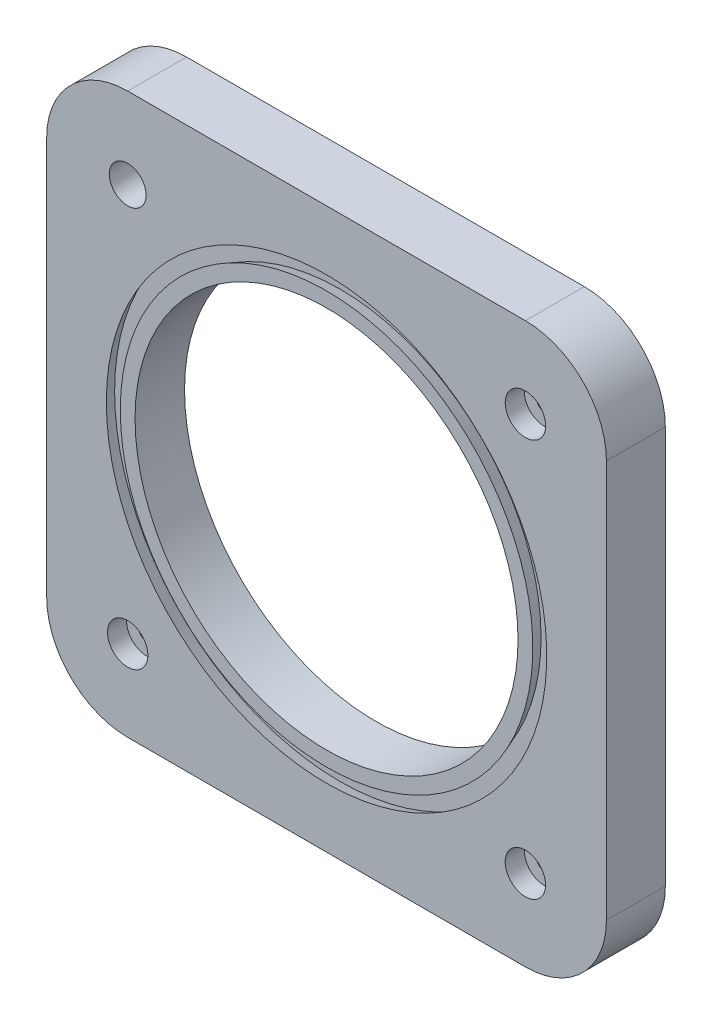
SolidWorks part; units mm, degrees
ref_plane "Plane1" through (0, 0, 0) normal (0, 0, 1) x (1, 0, 0)
ref_plane "Plane2" through (0, 0, 0) normal (0, 1, 0) x (1, 0, 0)
ref_plane "Plane3" through (0, 0, 0) normal (1, 0, 0) x (0, 0, -1)
sketch "Sketch1" plane through (0, 0, 0) normal (0, 0, 1) x (1, 0, 0)
  line L0 (120.65, 85.725) -> (120.65, -85.725)
  line L1 (-120.65, 85.725) -> (-120.65, -85.725)
  line L2 (85.725, -120.65) -> (-85.725, -120.65)
  line L3 (85.725, 120.65) -> (-85.725, 120.65)
  arc A0 (-120.65, 85.725) -> (-85.725, 120.65) centre (-85.725, 85.725) cw
  arc A1 (-85.725, -120.65) -> (-120.65, -85.725) centre (-85.725, -85.725) cw
  arc A2 (85.725, -120.65) -> (120.65, -85.725) centre (85.725, -85.725) ccw
  arc A3 (85.725, 120.65) -> (120.65, 85.725) centre (85.725, 85.725) cw
  circle A4 centre (0, 0) radius 82.55
  circle A5 centre (-85.725, -85.725) radius 3.3655
  circle A7 centre (85.725, 85.725) radius 3.3655
  circle A8 centre (85.725, -85.725) radius 3.3655
  circle A9 centre (-85.725, 85.725) radius 7.9375
  point P5 (-120.65, 120.65)
  point P14 (120.65, 120.65)
  dimension "D5" = 165.1
  dimension "D6" = 85.725
  dimension "D7" = 34.925
  dimension "D9" = 34.925
  dimension "D10" = 85.725
  dimension "D11" = 85.725
  dimension "D8" = 34.925
  dimension "D12" = 85.725
  dimension "D13" = 85.725
  dimension "D14" = 120.65
  dimension "D15" = 6.731
  dimension "D16" = 6.731
  dimension "D17" = 6.731
  dimension "D18" = 15.875
  dimension "D21" = 85.725
  dimension "D22" = 34.925
  dimension "D23" = 171.45
  dimension "D2" = 120.65
  dimension "D3" = 241.3
  dimension "D4" = 241.3
  dimension "D19" = 85.725
  dimension "D20" = 85.725
extrude "Base-Extrude" add sketch "Sketch1" along normal blind 25.4
sketch "Sketch2" plane through (0, 0, 25.4) normal (0, 0, 1) x (1, 0, 0)
  circle A0 centre (0, 0) radius 95.5675
  dimension "D1" = 191.135
sketch "Sketch3" plane through (0, 0, 25.4) normal (0, 0, 1) x (1, 0, 0)
  circle A0 centre (0, 0) radius 94.9325
  dimension "D1" = 189.865
sketch "Sketch4" plane through (0, 0, 0) normal (1, 0, 0) x (0, 0, -1)
  line L0 (-25.4, 94.9325) -> (-25.4, 77.5467) construction
  line L1 (-25.4, 94.9325) -> (-25.4, -94.9325) construction
  line L6 (-25.4, 91.9226) -> (-18.4374, 91.9226) construction
  line L8 (-19.6596, 97.1016) -> (-25.4, 94.9325)
  line L9 (-19.6596, 97.1016) -> (-19.6596, 86.7436)
  line L10 (-19.6596, 86.7436) -> (-25.4, 88.9127)
  line L11 (-25.4, 88.9127) -> (-25.4, 94.9325)
  point P11 (-19.6596, 91.9226)
  point P19 (-19.6596, 91.9226)
  dimension "D2" = 6.0198
  dimension "D3" = 41.4
  dimension "D4" = 5.7404
  dimension "D5" = 20.7
sweep "Cut-Sweep1" cut profiles "Sketch4" path "Sketch3"
sketch "Sketch5" plane through (0, 0, 25.4) normal (0, 0, 1) x (1, 0, 0)
  circle A0 centre (0, 0) radius 95.5675
  dimension "D1" = 191.135
extrude "Cut-Extrude2" [suppressed] cut sketch "Sketch5" against normal blind 4.572
sketch "Sketch6" plane through (0, 0, 0) normal (0, 0, -1) x (-1, 0, 0)
  line L0 (0, 0) -> (32.9785, 0) construction
  line L1 (0, 0) -> (0, 48.0821) construction
  circle A0 centre (85.725, -85.725) radius 6.477
  circle A1 centre (-85.725, -85.725) radius 6.477
  circle A2 centre (-85.725, 85.725) radius 6.477
  circle A3 centre (85.725, -85.725) radius 3.3655 construction
  dimension "D1" = 12.954
extrude "Cut-Extrude3" cut sketch "Sketch6" against normal blind 2.54
sketch "Sketch7" plane through (0, 0, 25.4) normal (0, 0, 1) x (1, 0, 0)
  line L0 (0, 0) -> (0, 21.2005) construction
  line L1 (0, 0) -> (27.713, 0) construction
  circle A0 centre (85.725, -85.725) radius 8.7122
  circle A1 centre (85.725, 85.725) radius 8.7122
  circle A2 centre (-85.725, -85.725) radius 8.7122
  circle A3 centre (85.725, -85.725) radius 3.3655 construction
  dimension "D1" = 17.4244
extrude "Cut-Extrude4" cut sketch "Sketch7" against normal blind 8.255
sketch "Sketch8" plane through (0, 0, 0) normal (0, 0, -1) x (-1, 0, 0)
  circle A0 centre (0, 0) radius 95.5675
  circle A1 centre (0, 0) radius 76.2
  dimension "D1" = 191.135
  dimension "D2" = 152.4
extrude "Cut-Extrude5" cut sketch "Sketch8" against normal blind 4.064
sketch "Sketch11" plane through (0, 0, 25.4) normal (0, 0, 1) x (1, 0, 0)
  line L4 (-120.65, 85.725) -> (-120.65, -85.725)
  line L5 (-85.725, -120.65) -> (85.725, -120.65)
  line L6 (120.65, -85.725) -> (120.65, 85.725)
  line L7 (85.725, 120.65) -> (-85.725, 120.65)
  line L8 (-120.65, 85.725) -> (-120.65, -85.725)
  line L9 (-85.725, -120.65) -> (85.725, -120.65)
  line L10 (120.65, -85.725) -> (120.65, 85.725)
  line L11 (85.725, 120.65) -> (-85.725, 120.65)
  arc A4 (-85.725, 120.65) -> (-120.65, 85.725) centre (-85.725, 85.725) ccw
  arc A5 (-120.65, -85.725) -> (-85.725, -120.65) centre (-85.725, -85.725) ccw
  arc A6 (85.725, -120.65) -> (120.65, -85.725) centre (85.725, -85.725) ccw
  arc A7 (120.65, 85.725) -> (85.725, 120.65) centre (85.725, 85.725) ccw
  arc A8 (-85.725, 120.65) -> (-120.65, 85.725) centre (-85.725, 85.725) ccw
  arc A9 (-120.65, -85.725) -> (-85.725, -120.65) centre (-85.725, -85.725) ccw
  arc A10 (85.725, -120.65) -> (120.65, -85.725) centre (85.725, -85.725) ccw
  arc A11 (120.65, 85.725) -> (85.725, 120.65) centre (85.725, 85.725) ccw
  dimension "D1" = 0
